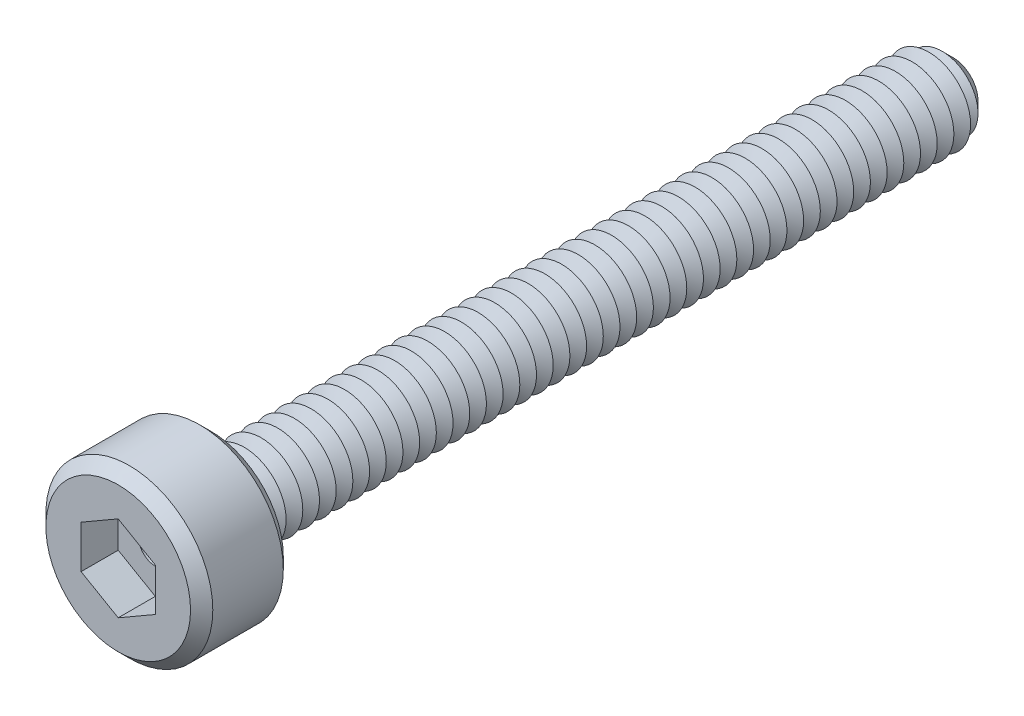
SolidWorks part; units mm, degrees
ref_plane "Front Plane" through (0, 0, 0) normal (0, 0, 1) x (1, 0, 0)
ref_plane "Top Plane" through (0, 0, 0) normal (0, 1, 0) x (1, 0, 0)
ref_plane "Right Plane" through (0, 0, 0) normal (1, 0, 0) x (0, 0, -1)
sketch "Sketch1" plane through (0, 0, 0) normal (0, 0, 1) x (1, 0, 0)
  circle A0 centre (0, 0) radius 2.25
  dimension "D1" = 4.5
extrude "Boss-Extrude1" add sketch "Sketch1" along normal blind 2.5
sketch "Sketch2" plane through (0, 0, 0) normal (0, 0, -1) x (-1, 0, 0)
  circle A0 centre (0, 0) radius 1.125
  dimension "D1" = 2.25
extrude "Boss-Extrude2" add sketch "Sketch2" along normal blind 20
chamfer "Chamfer1" distance 0.45 angle 45 1 edges at (-1.125, 0, -20)
sketch "Sketch3" plane through (0, 0, 0) normal (1, 0, 0) x (0, 0, -1)
  line L0 (-2.5121, 0) -> (4.5776, 0) construction
sketch "Sketch4" plane through (0, 0, 0) normal (1, 0, 0) x (0, 0, -1)
  line L0 (0, 1.125) -> (0.225, 0.7353)
  line L1 (0.225, 0.7353) -> (0.45, 1.125)
  line L2 (19.55, 1.125) -> (0, 1.125) construction
  line L3 (0.45, 1.125) -> (0, 1.125)
  dimension "D1" = 0.45
revolve "Cut-Revolve1" cut sketch "Sketch4" angle 360 about L0
pattern_linear "LPattern1" count 44 spacing 0.45 along (0, 0, -1) of "Cut-Revolve1"
sketch "Sketch5" plane through (0, 0, 2.5) normal (0, 0, 1) x (1, 0, 0)
  line L1 (0, 1.1547) -> (-1, 0.5774)
  line L2 (-1, 0.5774) -> (-1, -0.5774)
  line L3 (-1, -0.5774) -> (0, -1.1547)
  line L4 (0, -1.1547) -> (1, -0.5774)
  line L5 (1, -0.5774) -> (1, 0.5774)
  line L6 (1, 0.5774) -> (0, 1.1547)
  circle A0 centre (0, 0) radius 1 construction
  dimension "D1" = 2
extrude "Cut-Extrude1" cut sketch "Sketch5" against normal blind 1
sketch "Sketch6" plane through (0, 0, 1.5) normal (0, 0, 1) x (1, 0, 0)
  circle A0 centre (0, 0) radius 0.45
  dimension "D1" = 0.9
extrude "Cut-Extrude2" cut sketch "Sketch6" against normal up to surface (21.5 mm away)
chamfer "Chamfer2" distance 0.3 angle 45 2 edges at (2.25, 0, 0) (2.25, 0, 2.5)
